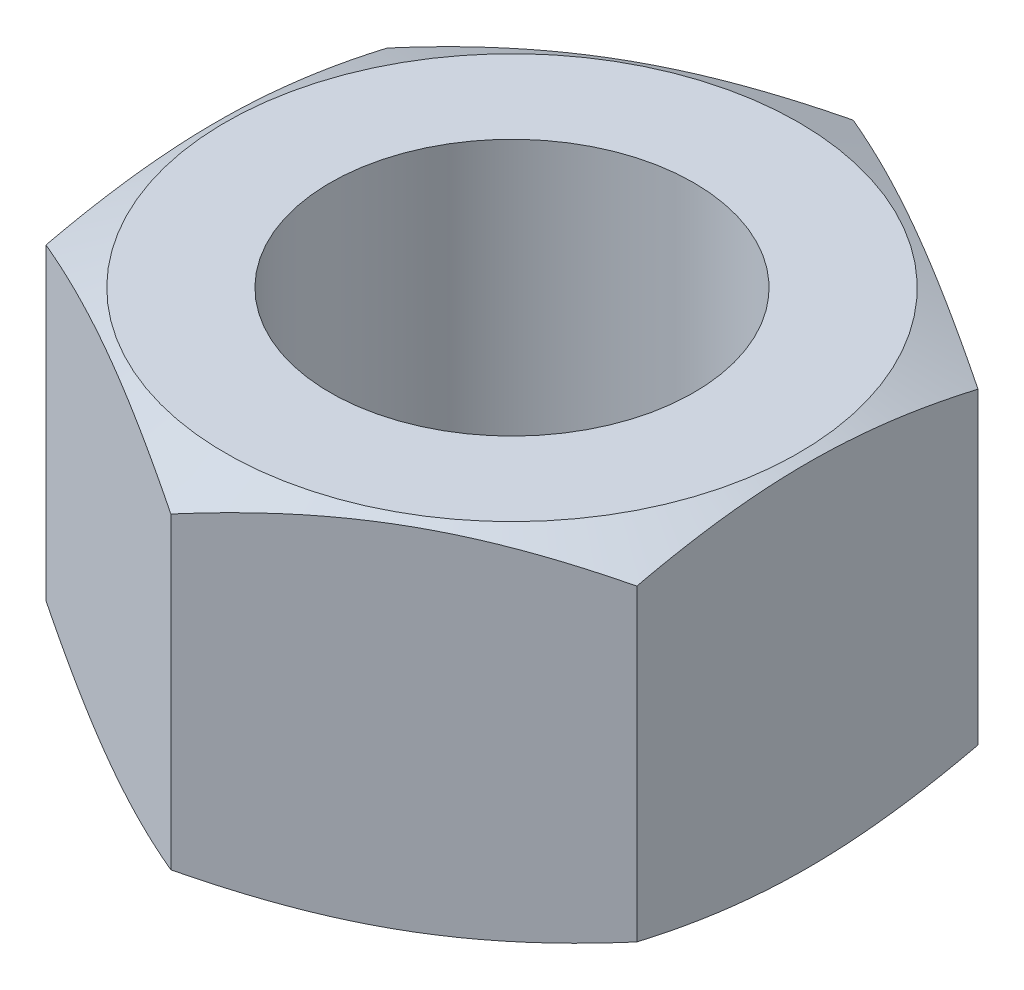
SolidWorks part; units mm, degrees
ref_plane "Face" through (0, 0, 0) normal (0, 0, 1) x (1, 0, 0)
ref_plane "Dessus" through (0, 0, 0) normal (0, 1, 0) x (1, 0, 0)
ref_plane "Droite" through (0, 0, 0) normal (1, 0, 0) x (0, 0, -1)
sketch "Esquisse1" plane through (0, 0, 0) normal (0, 0, 1) x (1, 0, 0)
  line L0 (0, -79) -> (0, 86.9) construction
  line L1 (4, 0) -> (4, 7.9)
  line L2 (4, 7.9) -> (6.3047, 7.9)
  line L3 (6.3047, 7.9) -> (7.5056, 7.34)
  line L4 (7.5056, 7.34) -> (7.5056, 0.56)
  line L5 (7.5056, 0.56) -> (6.3047, 0)
  line L6 (6.3047, 0) -> (4, 0)
revolve "Base-Révolution" add sketch "Esquisse1" angle 360 about L0
sketch "Esquisse2" plane through (0, 0, 0) normal (0, 1, 0) x (1, 0, 0)
  line L0 (6.5, 3.7528) -> (0, 7.5056)
  line L1 (0, 7.5056) -> (-6.5, 3.7528)
  line L2 (-6.5, 3.7528) -> (-6.5, -3.7528)
  line L3 (-6.5, -3.7528) -> (0, -7.5056)
  line L4 (0, -7.5056) -> (6.5, -3.7528)
  line L5 (6.5, -3.7528) -> (6.5, 3.7528)
  line L6 (8.2561, 8.2561) -> (-8.2561, 8.2561)
  line L7 (-8.2561, 8.2561) -> (-8.2561, -8.2561)
  line L8 (-8.2561, -8.2561) -> (8.2561, -8.2561)
  line L9 (8.2561, -8.2561) -> (8.2561, 8.2561)
extrude "Enlèv. mat.-Extru.1" cut sketch "Esquisse2" along normal blind 7.9
